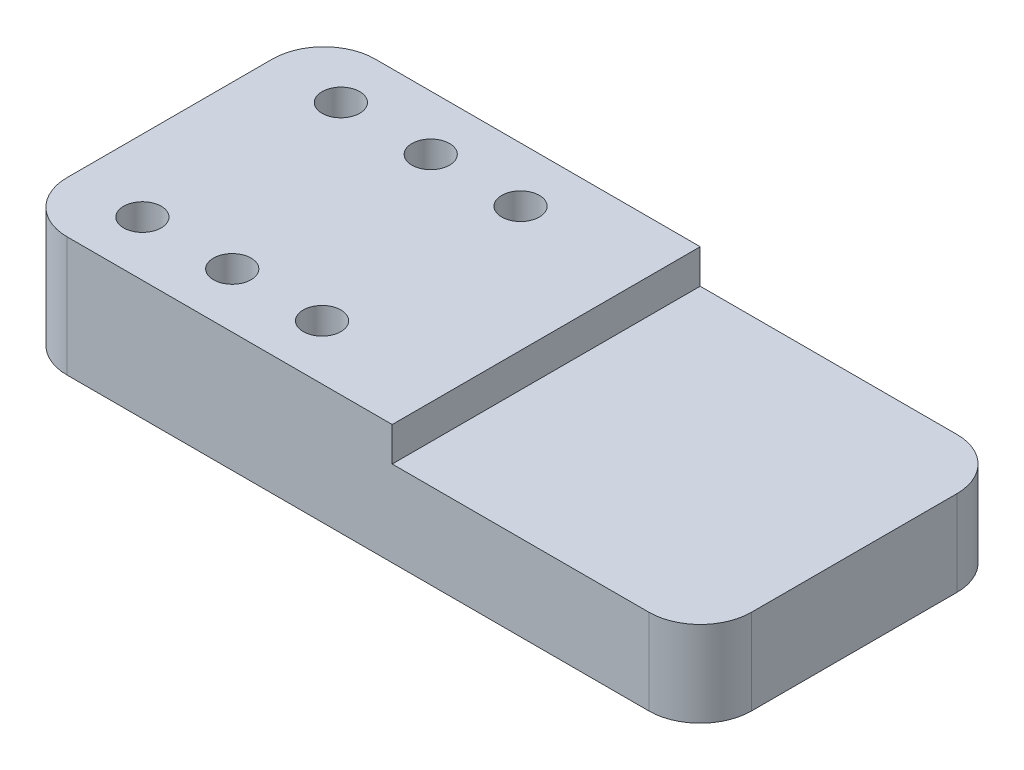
SolidWorks part; units mm, degrees
ref_plane "Front Plane" through (0, 0, 0) normal (0, 0, 1) x (1, 0, 0)
ref_plane "Top Plane" through (0, 0, 0) normal (0, 1, 0) x (1, 0, 0)
ref_plane "Right Plane" through (0, 0, 0) normal (1, 0, 0) x (0, 0, -1)
sketch "Sketch1" plane through (0, 0, 0) normal (0, 0, 1) x (1, 0, 0)
  line L1 (-200, 70) -> (20, 70)
  line L2 (-200, 70) -> (-200, 0)
  line L3 (-200, 0) -> (200, 0)
  line L4 (200, 50) -> (200, 0)
  line L5 (20, 70) -> (20, 50)
  line L6 (20, 50) -> (200, 50)
  dimension "D1" = 400
  dimension "D2" = 70
  dimension "D3" = 20
  dimension "D4" = 220
extrude "Boss-Extrude1" add sketch "Sketch1" along normal mid plane 180
fillet "Fillet1" radius 30 4 edges at (200, 25, 90) (200, 25, -90) (-200, 35, -90) (-200, 35, 90)
hole_wizard "M24x2.0 Tapped Hole1" positions "Sketch3" profile "Sketch2" tap size "M24x2.0" standard "ANSI Metric"
sketch "Sketch3" plane through (0, 70, 0) normal (0, 1, 0) x (1, 0, 0)
  line L0 (-158, 58) -> (-53, 58) construction
  line L2 (-200, -60) -> (-200, 60) construction
  line L3 (0, 0) -> (-200, 0) construction
  line L5 (-158, -58) -> (-53, -58) construction
  point P0 (-158, 58)
  point P2 (-105.5, 58)
  point P4 (-53, 58)
  point P19 (-158, -58)
  point P20 (-53, -58)
  point P21 (-105.5, -58)
  dimension "D1" = 105
  dimension "D2" = 42
  dimension "D3" = 58
sketch "Sketch2" plane through (-158, 70, -58) normal (1, 0, 0) x (0, 0, 1)
  line L0 (0, 0) -> (0, 55.118)
  line L1 (0, 55.118) -> (11, 55.118)
  line L2 (11, 55.118) -> (11, 0)
  line L5 (11, 0) -> (0, 0)
  line L10 (0, 55.118) -> (-11, 55.118) construction
  line L11 (0, -6.35) -> (0, 107.95) construction
  dimension "Tap Drill Dia." = 22
  dimension "Tap Drill Depth" = 55.118
  dimension "Drill Angle" = 180
